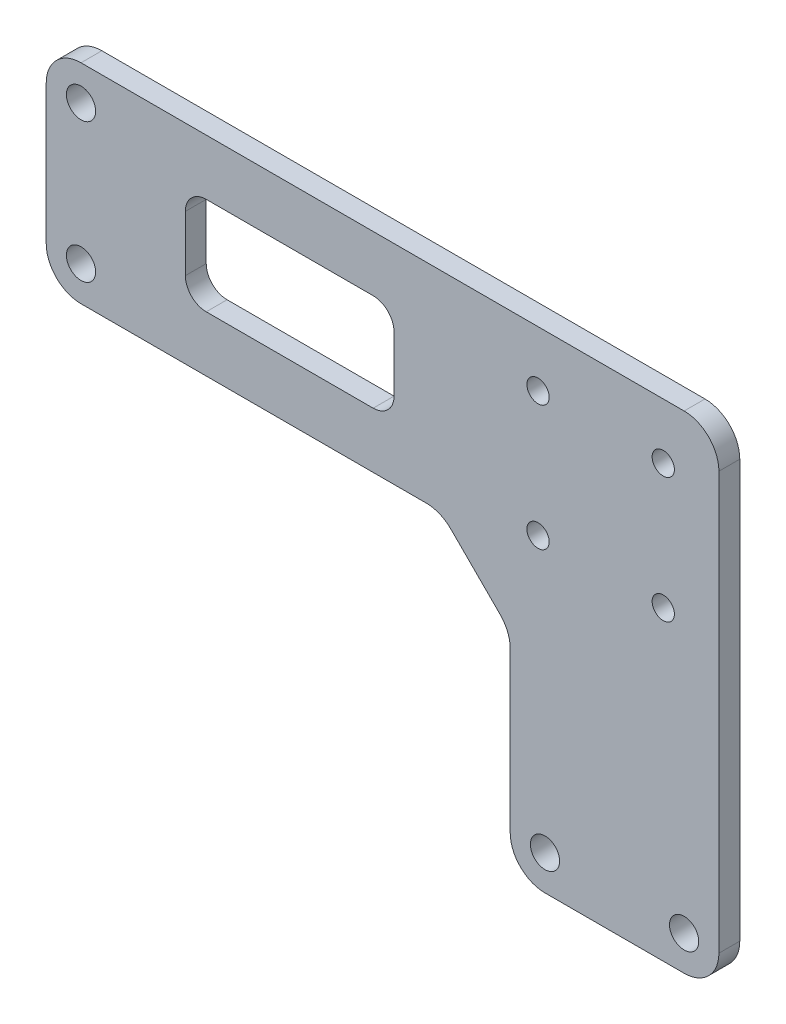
SolidWorks part; units mm, degrees
ref_plane "前视基准面" through (0, 0, 0) normal (0, 0, 1) x (1, 0, 0)
ref_plane "上视基准面" through (0, 0, 0) normal (0, 1, 0) x (1, 0, 0)
ref_plane "右视基准面" through (0, 0, 0) normal (1, 0, 0) x (0, 0, -1)
sketch "草图1" plane through (0, 0, 0) normal (0, 0, 1) x (1, 0, 0)
  line L0 (0, 0) -> (0, 30)
  line L1 (0, 30) -> (96.7, 30)
  line L2 (96.7, 30) -> (96.7, -40)
  line L3 (96.7, -40) -> (66.7, -40)
  line L4 (66.7, -40) -> (66.7, -10)
  line L5 (66.7, -10) -> (56.7, 0)
  line L6 (56.7, 0) -> (0, 0)
  line L7 (61.7, -5) -> (96.7, 30) construction
  line L8 (0, 15) -> (55.8253, 15) construction
  line L10 (20, 8) -> (50, 8)
  line L11 (20, 8) -> (20, 22)
  line L12 (20, 22) -> (50, 22)
  line L13 (50, 8) -> (50, 22)
  line L14 (20, 8) -> (50, 22) construction
  line L15 (20, 22) -> (50, 8) construction
  circle A0 centre (88.7, 22) radius 1.6
  circle A1 centre (70.7, 22) radius 1.6
  circle A2 centre (70.7, 4) radius 1.6
  circle A3 centre (88.7, 4) radius 1.6
  circle A4 centre (5, 5) radius 2.1
  circle A5 centre (5, 25) radius 2.1
  circle A6 centre (71.7, -35) radius 2.1
  circle A7 centre (91.7, -35) radius 2.1
  point P27 (35, 15)
  dimension "D7" = 3.2
  dimension "D12" = 5
  dimension "D15" = 5
  dimension "D18" = 4.2
  dimension "D19" = 4.2
  dimension "D13" = 4.2
  dimension "D14" = 5
  dimension "D16" = 4.2
  dimension "D1" = 30
  dimension "D2" = 30
  dimension "D3" = 45
  dimension "D4" = 56.7
  dimension "D5" = 30
  dimension "D6" = 96.7
  dimension "D8" = 8
  dimension "D9" = 8
  dimension "D17" = 5
  dimension "D20" = 5
  dimension "D21" = 5
  dimension "D22" = 5
  dimension "D23" = 5
  dimension "D24" = 8
  dimension "D25" = 30
  dimension "D26" = 20
  dimension "D10" = 2
  dimension "D11" = 2
extrude "凸台-拉伸1" add sketch "草图1" along normal blind 3
fillet "圆角1" radius 5 7 edges at (96.7, 30, 1.5) (96.7, -40, 1.5) (66.7, -40, 1.5) (56.7, 0, 1.5) (66.7, -10, 1.5) (0, 30, 1.5) (0, 0, 1.5)
fillet "圆角2" radius 3 4 edges at (20, 8, 1.5) (20, 22, 1.5) (50, 22, 1.5) (50, 8, 1.5)
